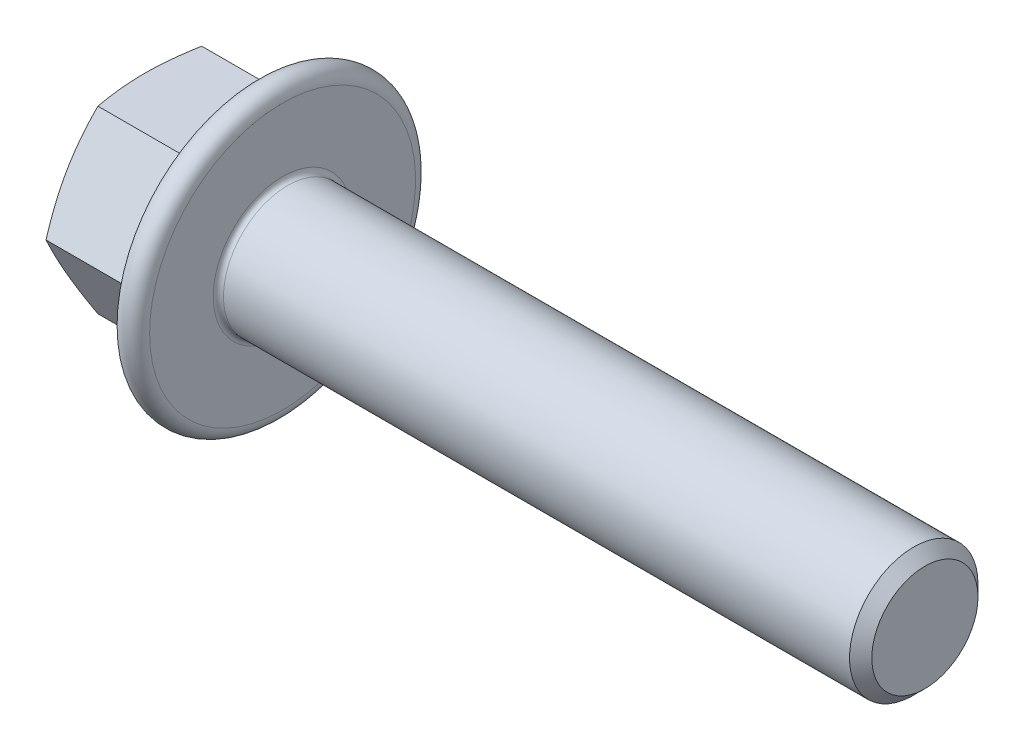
SolidWorks part; units mm, degrees
ref_plane "Front" through (0, 0, 0) normal (0, 0, 1) x (1, 0, 0)
ref_plane "Top" through (0, 0, 0) normal (0, 1, 0) x (1, 0, 0)
ref_plane "Right" through (0, 0, 0) normal (1, 0, 0) x (0, 0, -1)
sketch "Sketch1" plane through (0, 0, 0) normal (1, 0, 0) x (0, 0, -1)
  line L1 (2.0207, -3.5) -> (4.0415, 0)
  line L2 (4.0415, 0) -> (2.0207, 3.5)
  line L3 (2.0207, 3.5) -> (-2.0207, 3.5)
  line L4 (-2.0207, 3.5) -> (-4.0415, 0)
  line L5 (-4.0415, 0) -> (-2.0207, -3.5)
  line L6 (-2.0207, -3.5) -> (2.0207, -3.5)
  circle A0 centre (0, 0) radius 3.5 construction
  dimension "s" = 7
extrude "BaseHead" add sketch "Sketch1" along normal blind 5.6
ref_plane "Plane1" through (14.6, 0, 0) normal (1, 0, 0) x (0, 0, -1)
sketch "Sketch2" plane through (5.6, 0, 0) normal (1, 0, 0) x (0, 0, -1)
  circle A0 centre (0, 0) radius 2.5
  dimension "d" = 5
extrude "BaseBody" add sketch "Sketch2" along normal blind 25
sketch "Sketch3" plane through (2.5556, 0, 2.0632) normal (0, 1, 0) x (0, 0, -1)
  line L0 (6.1047, 2.5556) -> (6.1047, 2.1219)
  line L2 (6.1047, 2.1219) -> (4.9132, 2.5556)
  line L4 (4.9132, 2.5556) -> (6.1047, 2.5556)
  line L5 (2.0632, 3.5448) -> (2.0632, 2.0587) construction
  dimension "D1" = 20
  dimension "da" = 5.7
revolve "HeadChamfer" cut sketch "Sketch3" angle 360 about L5
sketch "Sketch5" plane through (-3.1384, 0, 9.9384) normal (0, 1, 0) x (0, 0, -1)
  line L0 (9.9384, -8.7384) -> (9.9384, -13.5308) construction
  line L1 (13.9799, -8.7384) -> (11.9591, -8.7384) construction
  line L2 (9.9384, -8.7384) -> (15.1138, -8.7384)
  line L3 (15.3355, -7.7384) -> (9.9384, -5.2217)
  line L4 (9.9384, -5.2217) -> (9.9384, -8.7384)
  line L5 (9.9384, -33.7384) -> (9.9384, -8.7384) construction
  arc A0 (15.1138, -8.7384) -> (15.3355, -7.7384) centre (15.1138, -8.2138) ccw
  dimension "D3" = 25
  dimension "c" = 1
  dimension "dc" = 11.4
revolve "Revolve1" add sketch "Sketch5" angle 360 about L0
fillet "HeadFillet" radius 0.2 1 edges at (5.6, 0, -2.5)
fillet "FlangeHexFillet" radius 0.3 6 edges at (3.7732, -0.9358, -3.5012) (3.7732, 2.5642, -2.561) (3.7732, -2.5642, 2.561) (3.7732, 0.9358, 3.5012)
chamfer "Chamfer1" distance 0.433 angle 45 1 edges at (30.6, 0, -2.5)
equation "\"b@ThreadCosmetic1\" = \"l@BaseBody\" - \"lg@Plane1\""
equation "\"D1@Chamfer1\" = (  \"d@Sketch2\" - \"D2@ThreadCosmetic1\" )  / 2"
